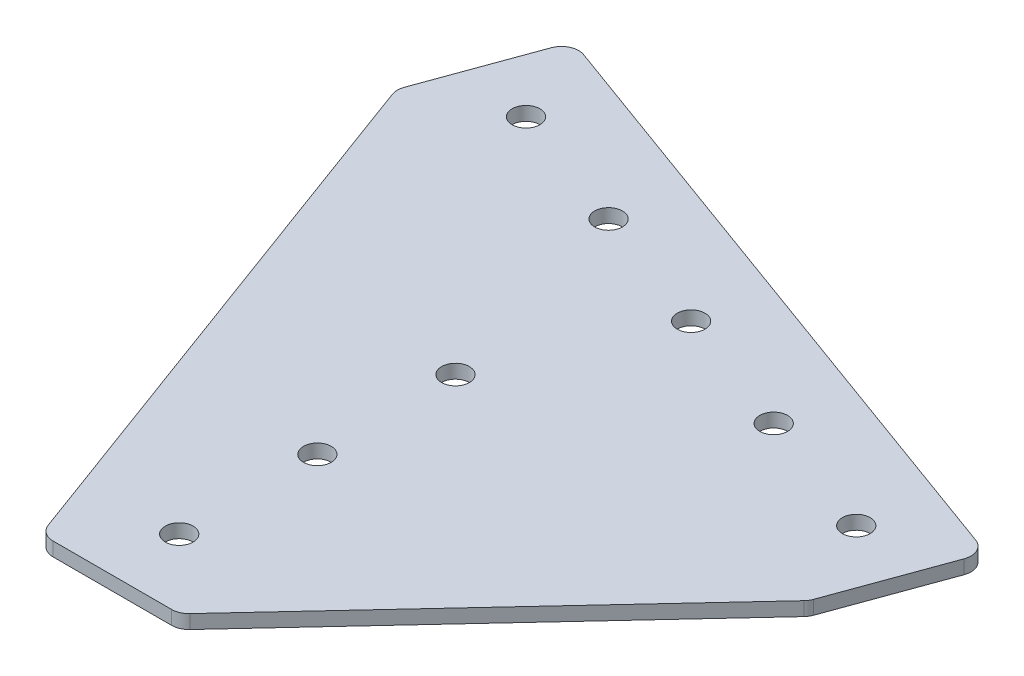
SolidWorks part; units mm, degrees
ref_plane "Front Plane" through (0, 0, 0) normal (0, 0, 1) x (1, 0, 0)
ref_plane "Top Plane" through (0, 0, 0) normal (0, 1, 0) x (1, 0, 0)
ref_plane "Right Plane" through (0, 0, 0) normal (1, 0, 0) x (0, 0, -1)
sketch "Sketch1" plane through (0, 0, 0) normal (0, 1, 0) x (1, 0, 0)
  line L0 (0, 0) -> (-38.152, 103.4517)
  line L1 (-38.152, 103.4517) -> (-29.4647, 127.3199)
  line L2 (-29.4647, 127.3199) -> (89.8762, 83.8833)
  line L3 (89.8762, 83.8833) -> (81.1889, 60.0152)
  line L4 (81.1889, 60.0152) -> (25.4, 0)
  line L5 (25.4, 0) -> (0, 0)
  line L6 (-38.152, 103.4517) -> (81.1889, 60.0152) construction
  line L7 (0, 0) -> (25.4, 0) construction
  line L8 (0, 0) -> (0, 76.2) construction
  line L9 (0, 76.2) -> (25.4, 76.2) construction
  line L10 (25.4, 0) -> (25.4, 76.2) construction
  line L11 (0, 0) -> (25.4, 76.2) construction
  line L12 (0, 76.2) -> (25.4, 0) construction
  line L13 (-33.8084, 115.3858) -> (85.5326, 71.9493) construction
  line L14 (12.7, 76.2) -> (12.7, 0) construction
  point P10 (12.7, 38.1)
  point P14 (12.7, 63.5)
  point P15 (12.7, 12.7)
  point P16 (-21.8743, 111.0422)
  point P17 (1.9939, 102.3548)
  point P18 (25.8621, 93.6675)
  point P19 (49.7303, 84.9802)
  point P20 (73.5985, 76.2929)
  dimension "D1" = 25.4
  dimension "D2" = 20
  dimension "D3" = 76.2
  dimension "D4" = 17.4675
  dimension "D5" = 12.7
  dimension "D6" = 25.4
  dimension "D7" = 25.4
  dimension "D8" = 25.4
  dimension "D9" = 25.4
  dimension "D10" = 25.4
  dimension "D11" = 12.7
  dimension "D12" = 12.7
  dimension "D13" = 38.152
extrude "Boss-Extrude1" add sketch "Sketch1" along normal blind 2.54
hole_wizard "#7 (0.201) Diameter Hole1" positions "Sketch2" profile "Sketch3" hole size "#7" standard "ANSI Inch"
sketch "Sketch2" plane through (0, 0, 0) normal (0, -1, 0) x (-1, 0, 0)
  line L0 (33.8084, 115.3858) -> (-85.5326, 71.9493) construction
  point P0 (-73.5985, 76.2929)
  point P3 (-49.7303, 84.9802)
  point P6 (-25.8621, 93.6675)
  point P10 (-1.9939, 102.3548)
  point P13 (21.8743, 111.0422)
  point P16 (-12.7, 63.5)
  point P19 (-12.7, 38.1)
  point P22 (-12.7, 12.7)
sketch "Sketch3" plane through (73.5985, 0, -76.2929) normal (1, 0, 0) x (0, 0, -1)
  line L0 (0, 0) -> (0, 2.54)
  line L1 (0, 2.54) -> (2.5527, 2.54)
  line L2 (2.5527, 2.54) -> (2.5527, 0)
  line L5 (2.5527, 0) -> (0, 0)
  line L11 (0, -6.35) -> (0, 107.95) construction
  dimension "Thru Hole Dia." = 5.1054
  dimension "Thru Hole Depth" = 2.54
fillet "Fillet1" radius 3.175 6 edges at (-38.152, 1.27, -103.4517) (-29.4647, 1.27, -127.3199) (0, 1.27, 0) (25.4, 1.27, 0) (81.1889, 1.27, -60.0152) (89.8762, 1.27, -83.8833)
